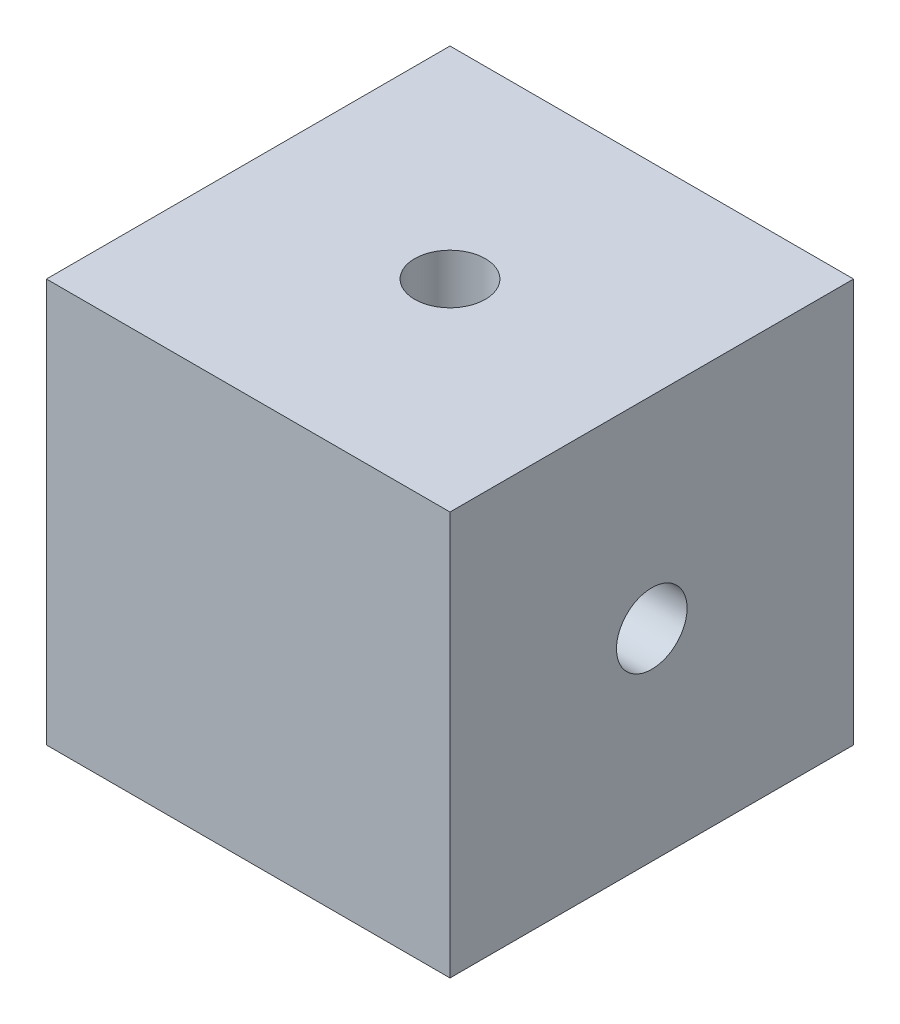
SolidWorks part; units mm, degrees
ref_plane "Front Plane" through (0, 0, 0) normal (0, 0, 1) x (1, 0, 0)
ref_plane "Top Plane" through (0, 0, 0) normal (0, 1, 0) x (1, 0, 0)
ref_plane "Right Plane" through (0, 0, 0) normal (1, 0, 0) x (0, 0, -1)
sketch "Sketch1" plane through (0, 0, 0) normal (0, 1, 0) x (1, 0, 0)
  line L0 (20, 20) -> (0, 0) construction
  line L1 (0, 0) -> (20, 0)
  line L2 (0, 0) -> (0, 20)
  line L3 (0, 20) -> (20, 20)
  line L4 (20, 0) -> (20, 20)
  circle A0 centre (10, 10) radius 1.75
  dimension "D3" = 3.5
  dimension "D1" = 20
  dimension "D2" = 20
extrude "Extrude1" add sketch "Sketch1" along normal blind 20
sketch "Sketch2" plane through (20, 0, 0) normal (1, 0, 0) x (0, 0, -1)
  line L0 (20, 20) -> (0, 0) construction
  circle A0 centre (10, 10) radius 1.75
  dimension "D1" = 3.5
extrude "Extrude2" cut sketch "Sketch2" against normal through all
